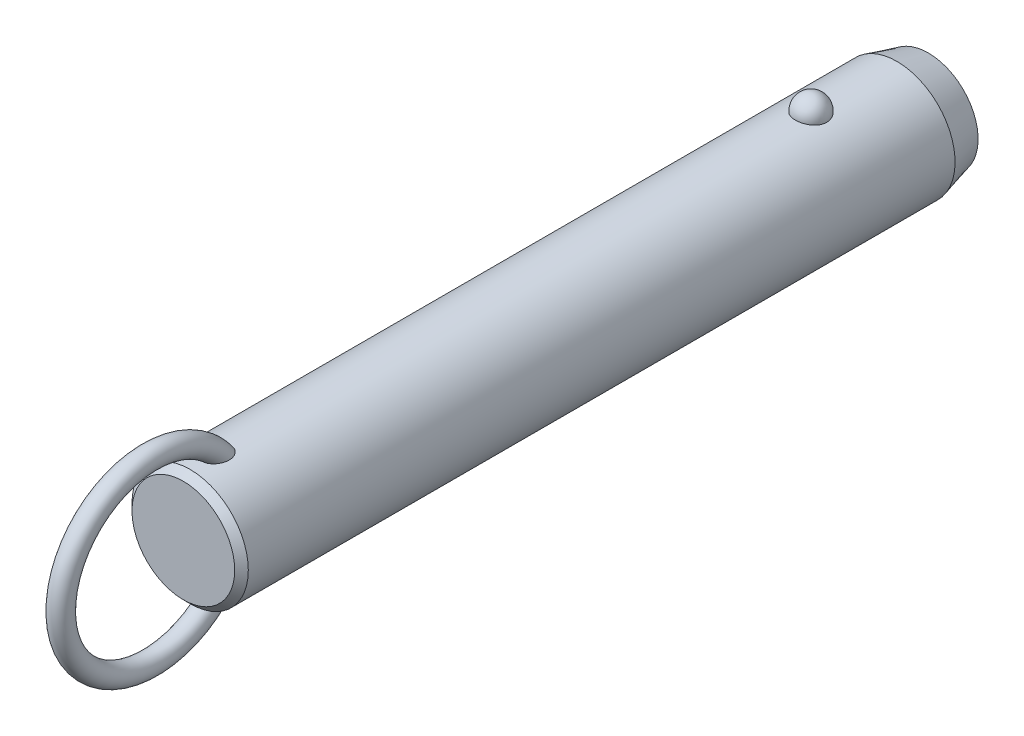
SolidWorks part; units mm, degrees
ref_plane "Front Plane" through (0, 0, 0) normal (0, 0, 1) x (1, 0, 0)
ref_plane "Top Plane" through (0, 0, 0) normal (0, 1, 0) x (1, 0, 0)
ref_plane "Right Plane" through (0, 0, 0) normal (1, 0, 0) x (0, 0, -1)
sketch "Sketch2" plane through (0, 0, 0) normal (0, 0, 1) x (1, 0, 0)
  circle A0 centre (0, 0) radius 11.1
  point P3 (0, 11.1)
  dimension "D1" = 22.2
extrude "Boss-Extrude1" add sketch "Sketch2" along normal blind 104.1
sketch "Sketch3" plane through (0, 0, 0) normal (0, 0, -1) x (-1, 0, 0)
  circle A0 centre (0, 0) radius 11.1
  dimension "D1" = 22.2
extrude "Boss-Extrude2" add sketch "Sketch3" along normal blind 25.4
chamfer "Chamfer1" distance 6 angle 15 1 edges at (-11.1, 0, -25.4)
sketch "Sketch12" plane through (0, 0, 0) normal (1, 0, 0) x (0, 0, -1)
  line L0 (-104.1, 11.1) -> (-104.1, -11.1) construction
  point P0 (-104.1, 0)
sketch "Sketch13" plane through (0, 0, 0) normal (1, 0, 0) x (0, 0, -1)
  circle A0 centre (-123.15, 0) radius 19.05
  point P2 (-104.1, 0)
  dimension "D1" = 38.1
sketch "Sketch14" plane through (0, 0, 0) normal (0, 1, 0) x (1, 0, 0)
  circle A0 centre (0, -106.1) radius 2
  point P2 (0, -104.1)
  dimension "D1" = 4
sweep "Sweep1" add profiles "Sketch14" path "Sketch13"
sketch "Sketch15" plane through (0, 0, 104.1) normal (0, 0, 1) x (1, 0, 0)
  circle A0 centre (0, 0) radius 11.1
  dimension "D1" = 22.2
extrude "Boss-Extrude3" add sketch "Sketch15" along normal blind 12.7
chamfer "Chamfer2" distance 1.3 angle 45 1 edges at (11.1, 0, 116.8)
sketch "Sketch18" plane through (0, 0, 0) normal (1, 0, 0) x (0, 0, -1)
  line L0 (19.4, 11.1) -> (-107.668, 11.1) construction
  line L1 (3, 14.1) -> (3, 8.1)
  line L2 (-107.668, -11.1) -> (19.4, -11.1) construction
  arc A0 (3, 14.1) -> (3, 8.1) centre (3, 11.1) ccw
  point P4 (0, 11.1)
  dimension "D1" = 25.2
revolve "Revolve1" add sketch "Sketch18" angle 360 about L1
